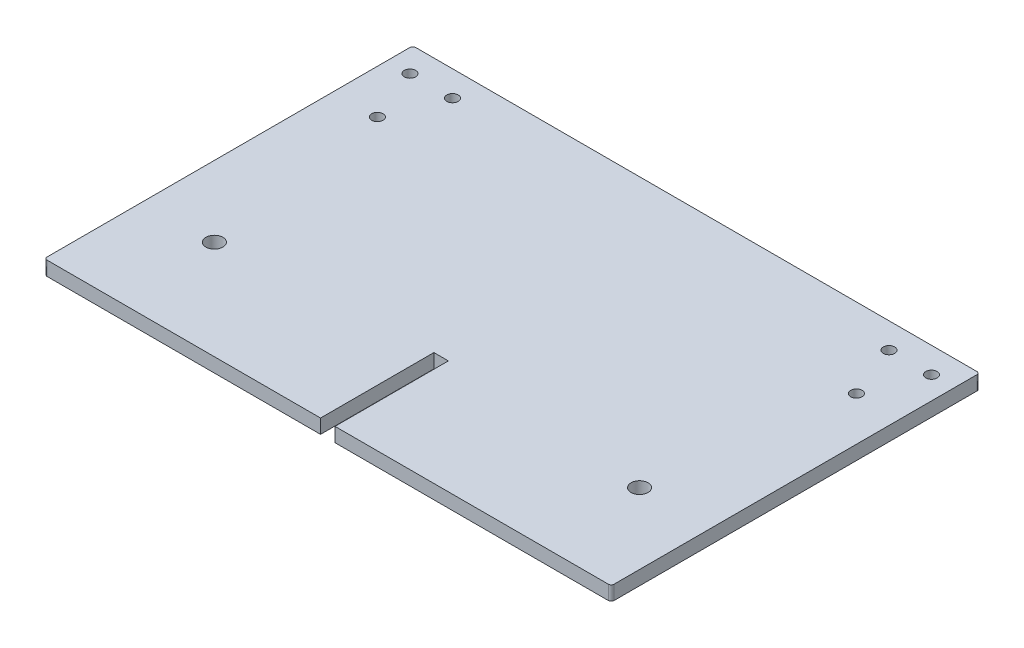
SolidWorks part; units mm, degrees
ref_plane "Front Plane" through (0, 0, 0) normal (0, 0, 1) x (1, 0, 0)
ref_plane "Top Plane" through (0, 0, 0) normal (0, 1, 0) x (1, 0, 0)
ref_plane "Right Plane" through (0, 0, 0) normal (1, 0, 0) x (0, 0, -1)
sketch "Sketch1" plane through (0, 0, 0) normal (0, 1, 0) x (1, 0, 0)
  line L0 (100, -130) -> (100, -90) construction
  line L1 (0, 0) -> (200, 0)
  line L2 (0, 0) -> (0, -130)
  line L3 (0, -130) -> (97.45, -130)
  line L4 (200, 0) -> (200, -130)
  line L6 (102.55, -130) -> (102.55, -90)
  line L7 (102.55, -90) -> (97.45, -90)
  line L8 (97.45, -130) -> (97.45, -90)
  line L10 (102.55, -130) -> (200, -130)
  circle A0 centre (8, -9) radius 2
  circle A1 centre (23, -9) radius 2
  circle A2 centre (15.5, -28) radius 2
  circle A3 centre (25, -95) radius 3
  circle A4 centre (175, -95) radius 3
  circle A5 centre (184.5, -28) radius 2
  circle A6 centre (177, -9) radius 2
  circle A7 centre (192, -9) radius 2
  dimension "D3" = 4
  dimension "D4" = 4
  dimension "D5" = 4
  dimension "D7" = 19
  dimension "D8" = 7.5
  dimension "D10" = 9
  dimension "D11" = 6
  dimension "D12" = 35
  dimension "D13" = 25
  dimension "D1" = 200
  dimension "D2" = 130
  dimension "D6" = 15
  dimension "D9" = 8
  dimension "D14" = 2.55
  dimension "D15" = 40
extrude "Boss-Extrude1" add sketch "Sketch1" along normal blind 5
fillet "Fillet1" radius 1 4 edges at (0, 2.5, 0) (0, 2.5, 130) (200, 2.5, 0) (200, 2.5, 130)
